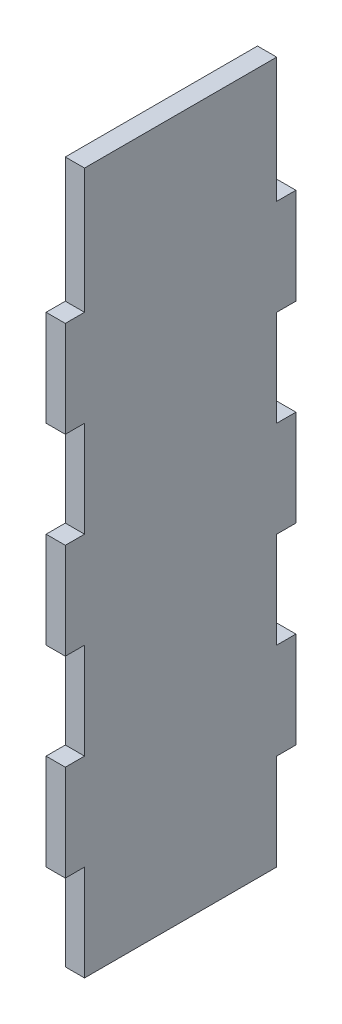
SolidWorks part; units mm, degrees
ref_plane "Front Plane" through (0, 0, 0) normal (0, 0, 1) x (1, 0, 0)
ref_plane "Top Plane" through (0, 0, 0) normal (0, 1, 0) x (1, 0, 0)
ref_plane "Right Plane" through (0, 0, 0) normal (1, 0, 0) x (0, 0, -1)
sketch "Sketch1" plane through (0, 0, 0) normal (0, 0, 1) x (1, 0, 0)
  line L0 (-30, 69) -> (12, 69) construction
  line L1 (-30, -4) -> (-28, -4)
  line L2 (-30, -4) -> (-30, 69)
  line L3 (-30, 69) -> (-28, 69)
  line L4 (-28, -4) -> (-28, 69)
extrude "Boss-Extrude1" add sketch "Sketch1" along normal up to surface (20 mm away)
sketch "Sketch3" plane through (0, 0, 0) normal (0, 0, -1) x (-1, 0, 0)
  line L0 (28, -4) -> (28, 69) construction
  line L1 (28, 6) -> (30, 6)
  line L2 (28, 6) -> (28, 16)
  line L3 (28, 16) -> (30, 16)
  line L4 (30, 6) -> (30, 16)
  line L5 (30, 69) -> (30, -4) construction
  line L6 (30, -4) -> (28, -4) construction
  point P10 (29, -4)
  dimension "D1" = 10
  dimension "D2" = 10
extrude "Boss-Extrude2" add sketch "Sketch3" along normal blind 2
pattern_linear "LPattern1" count 3 spacing 20 along (0, 1, 0) of "Boss-Extrude2"
sketch "Sketch4" plane through (0, 0, 20) normal (0, 0, 1) x (1, 0, 0)
  line L0 (-28, 56) -> (-28, 46) construction
  line L1 (-28, 46) -> (-30, 46) construction
  line L2 (-30, 46) -> (-30, 56) construction
  line L3 (-30, 56) -> (-28, 56) construction
  line L4 (-28, 36) -> (-28, 26) construction
  line L5 (-28, 26) -> (-30, 26) construction
  line L6 (-30, 26) -> (-30, 36) construction
  line L7 (-30, 36) -> (-28, 36) construction
  line L8 (-28, 16) -> (-28, 6) construction
  line L9 (-28, 6) -> (-30, 6) construction
  line L10 (-30, 6) -> (-30, 16) construction
  line L11 (-30, 16) -> (-28, 16) construction
  line L12 (-28, 56) -> (-28, 46)
  line L13 (-28, 46) -> (-30, 46)
  line L14 (-30, 46) -> (-30, 56)
  line L15 (-30, 56) -> (-28, 56)
  line L16 (-28, 36) -> (-28, 26)
  line L17 (-28, 26) -> (-30, 26)
  line L18 (-30, 26) -> (-30, 36)
  line L19 (-30, 36) -> (-28, 36)
  line L20 (-28, 16) -> (-28, 6)
  line L21 (-28, 6) -> (-30, 6)
  line L22 (-30, 6) -> (-30, 16)
  line L23 (-30, 16) -> (-28, 16)
extrude "Boss-Extrude3" add sketch "Sketch4" along normal blind 2
equation "\"anch\" = 2"
equation "\"alt\" = 100"
equation "\"pilanch\" = 100"
equation "\"pilalt\" = 250"
equation "\"bodyHeigh\" = 60"
equation "\"dorsalFinHeigh\" = 400"
equation "\"D1@Sketch1\"=\"anch\""
equation "\"D1@Boss-Extrude2\"=\"anch\""
equation "\"D1@Boss-Extrude3\"=\"anch\""
